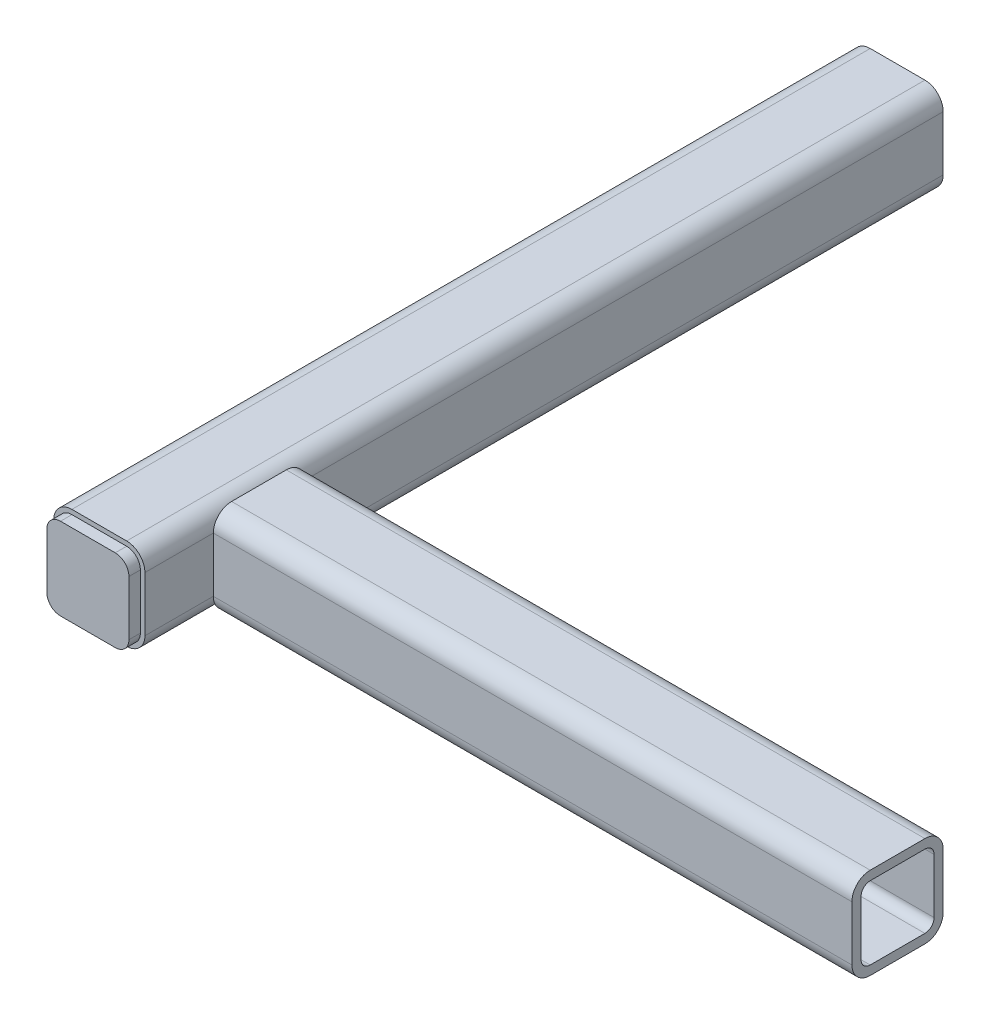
SolidWorks part; units mm, degrees
ref_plane "Front Plane" through (0, 0, 0) normal (0, 0, 1) x (1, 0, 0)
ref_plane "Top Plane" through (0, 0, 0) normal (0, 1, 0) x (1, 0, 0)
ref_plane "Right Plane" through (0, 0, 0) normal (1, 0, 0) x (0, 0, -1)
sketch "Sketch1" plane through (0, 0, 0) normal (0, 1, 0) x (1, 0, 0)
  line L0 (0, 150) -> (0, -25)
  line L1 (0, 0) -> (150, 0)
  dimension "D1" = 150
  dimension "D2" = 150
  dimension "D3" = 25
other "Square tube 20 X 20 X 2(1)"
ref_plane "Plane1" through (0, 0, -150) normal (0, 0, 1) x (1, 0, 0)
sketch "Sketch13" plane through (0, 0, -150) normal (0, 0, 1) x (1, 0, 0)
  line L0 (-6, -8) -> (6, -8)
  line L1 (-8, -6) -> (-8, 6)
  line L2 (6, 8) -> (-6, 8)
  line L3 (8, 6) -> (8, -6)
  line L4 (-6, -10) -> (6, -10)
  line L5 (-10, -6) -> (-10, 6)
  line L6 (6, 10) -> (-6, 10)
  line L7 (10, 6) -> (10, -6)
  arc A0 (10, 6) -> (6, 10) centre (6, 6) ccw
  arc A1 (6, -10) -> (10, -6) centre (6, -6) ccw
  arc A2 (-10, -6) -> (-6, -10) centre (-6, -6) ccw
  arc A3 (-6, 10) -> (-10, 6) centre (-6, 6) ccw
  arc A4 (-6, 8) -> (-8, 6) centre (-6, 6) ccw
  arc A5 (8, 6) -> (6, 8) centre (6, 6) ccw
  arc A6 (6, -8) -> (8, -6) centre (6, -6) ccw
  arc A7 (-8, -6) -> (-6, -8) centre (-6, -6) ccw
  point P0 (-10, 0)
  point P1 (10, 0)
  point P2 (0, 10)
  point P3 (0, -10)
  point P4 (0, 0)
  point P5 (-10, -10)
  point P6 (10, -10)
  point P7 (10, 10)
  point P8 (-10, 10)
  point P33 (0, 0)
  dimension "D1" = 4
  dimension "Thickness" = 2
  dimension "V_leg" = 20
other "End cap1" parameters "D1"=2.5, "D2"=3, "D3"=3
